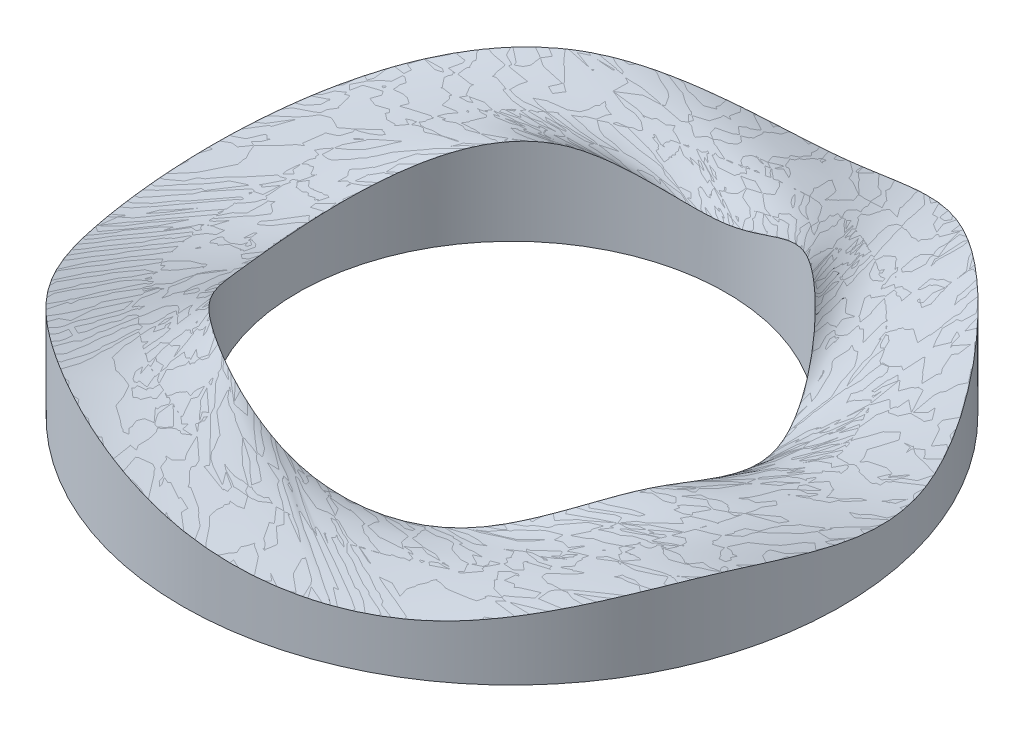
SolidWorks part; units mm, degrees
ref_plane "Ebene vorne" through (0, 0, 0) normal (0, 0, 1) x (1, 0, 0)
ref_plane "Ebene oben" through (0, 0, 0) normal (0, 1, 0) x (1, 0, 0)
ref_plane "Ebene rechts" through (0, 0, 0) normal (1, 0, 0) x (0, 0, -1)
sketch "Skizze1" plane through (0, 0, 0) normal (0, 1, 0) x (1, 0, 0)
  circle A0 centre (0, 0) radius 50
  circle A1 centre (0, 0) radius 32.5
  dimension "D1" = 100
  dimension "D2" = 65
extrude "Linear austragen1" add sketch "Skizze1" along normal blind 20
sketch "Skizze2" plane through (0, 20, 0) normal (0, 1, 0) x (1, 0, 0)
  line L0 (0, 0) -> (0, -50) construction
  line L1 (0, 0) -> (-29.3893, -40.4508) construction
  line L2 (0, 0) -> (-47.5528, -15.4508) construction
  line L3 (0, 0) -> (-47.5528, 15.4508) construction
  line L4 (0, 0) -> (-29.3893, 40.4508) construction
  line L5 (0, 0) -> (0, 50) construction
  line L6 (0, 0) -> (29.3893, 40.4508) construction
  line L7 (0, 0) -> (47.5528, 15.4508) construction
  line L8 (0, 0) -> (47.5528, -15.4508) construction
  line L9 (0, 0) -> (29.3893, -40.4508) construction
  circle A0 centre (0, 0) radius 50 construction
sketch3d "3D-Skizze1"
  spline S0 degree 3 poles (-31.4452, 18.6778, 43.0757) (-0.2043, 8.8385, 53.4326) (31.4376, 6.1421, 43.1658) (50.853, 14.6306, 16.5023) (50.5619, 1.1765, -17.1112) (31.5931, 22.8305, -42.9231) (0.2976, 3.7946, -53.4524) (-31.3557, 16.1997, -43.2221) (-50.7913, 9.3238, -16.6139) (-50.6782, 6.5436, 16.8503) (-31.4452, 18.6778, 43.0757) (-0.2043, 8.8385, 53.4326) (31.4376, 6.1421, 43.1658) knots -0.29941 -0.200615 -0.100028 0 0.09895 0.198157 0.297725 0.40057 0.501816 0.601383 0.70059 0.799385 0.899972 1 1.09895 1.198157 1.297725 only from (0, 10, 50) to (0, 10, 50)
  point P0 (0, 10, 50)
  point P1 (29.3893, 8, 40.4508)
  point P2 (47.5528, 11, 15.4508)
  point P5 (47.5528, 7, -15.4508)
  point P6 (29.3893, 16, -40.4508)
  point P7 (0, 9, -50)
  point P8 (-29.3893, 13, -40.4508)
  point P9 (-47.5528, 10, -15.4508)
  point P10 (-47.5528, 9, 15.4508)
  point P11 (-29.3893, 15, 40.4508)
  dimension "D1" = 10
  dimension "D2" = 15
  dimension "D3" = 8
  dimension "D4" = 11
  dimension "D5" = 7
  dimension "D6" = 16
  dimension "D7" = 9
  dimension "D8" = 13
  dimension "D9" = 10
  dimension "D10" = 9
sketch3d "3D-Skizze2"
  line L1 (0, 20, 0) -> (-29.3893, 20, -40.4508) construction
  line L2 (-19.103, 20, -26.2931) -> (-19.103, 0, -26.2931) construction
  line L3 (0, 20, -32.5) -> (0, 0, -32.5) construction
  line L4 (0, 20, 0) -> (0, 20, -50) construction
  line L6 (19.103, 20, -26.2931) -> (19.103, 0, -26.2931) construction
  line L7 (0, 20, 0) -> (29.3893, 20, -40.4508) construction
  line L10 (30.9093, 20, -10.0431) -> (30.9093, 0, -10.0431) construction
  line L11 (0, 20, 0) -> (47.5528, 20, -15.4508) construction
  line L12 (30.9093, 20, 10.0431) -> (30.9093, 0, 10.0431) construction
  line L13 (0, 20, 0) -> (47.5528, 20, 15.4508) construction
  line L14 (19.103, 20, 26.2931) -> (19.103, 0, 26.2931) construction
  line L15 (0, 20, 0) -> (29.3893, 20, 40.4508) construction
  line L16 (0, 20, 32.5) -> (0, 0, 32.5) construction
  line L17 (0, 20, 0) -> (0, 20, 50) construction
  line L18 (-19.103, 20, 26.2931) -> (-19.103, 0, 26.2931) construction
  line L19 (0, 20, 0) -> (-29.3893, 20, 40.4508) construction
  line L20 (-30.9093, 20, 10.0431) -> (-30.9093, 0, 10.0431) construction
  line L21 (0, 20, 0) -> (-47.5528, 20, 15.4508) construction
  line L22 (-30.9093, 20, -10.0431) -> (-30.9093, 0, -10.0431) construction
  line L23 (0, 20, 0) -> (-47.5528, 20, -15.4508) construction
  circle A0 centre (0, 20, 0) radius 32.5 construction
  circle A1 centre (0, 0, 0) radius 32.5 construction
  spline S0 degree 3 poles (-33.0182, 9.3339, -10.8954) (-20.352, 16.1576, -28.1137) (0.44, 3.8495, -34.7837) (20.6899, 22.8978, -27.6816) (32.6928, 1.2209, -11.6079) (33.1049, 14.5673, 10.7184) (20.4799, 6.1573, 28.0297) (-0.309, 8.8902, 34.7587) (-20.4853, 18.682, 27.8927) (-32.8515, 6.5963, 11.2501) (-33.0182, 9.3339, -10.8954) (-20.352, 16.1576, -28.1137) (0.44, 3.8495, -34.7837) knots -0.296796 -0.195436 -0.098197 0 0.099026 0.201875 0.308298 0.407324 0.505521 0.603121 0.703204 0.804564 0.901803 1 1.099026 1.201875 1.308298 only from (-19.103, 13, -26.2931) to (-19.103, 13, -26.2931)
  point P0 (-19.103, 15, 26.2931)
  point P1 (-30.9093, 9, 10.0431)
  point P2 (-30.9093, 10, -10.0431)
  point P3 (-19.103, 13, -26.2931)
  point P4 (0, 9, -32.5)
  point P5 (19.103, 16, -26.2931)
  point P9 (0, 10, 32.5)
  point P10 (19.103, 8, 26.2931)
  point P14 (0, 52.5, 0)
  point P17 (0, 32.5, 0)
  point P54 (30.9093, 11, 10.0431)
  point P55 (30.9093, 7, -10.0431)
  dimension "D1" = 16
  dimension "D2" = 9
  dimension "D3" = 13
  dimension "D4" = 10
  dimension "D5" = 9
  dimension "D6" = 15
  dimension "D7" = 7
  dimension "D8" = 11
  dimension "D9" = 8
  dimension "D10" = 10
sketch "Skizze3" plane through (0, 0, 0) normal (1, 0, 0) x (0, 0, -1)
  line L0 (-50, 10) -> (-32.5, 10) construction
surface "Oberfläche-Ausformung2"
sketch "Skizze5" plane through (0, 20, 0) normal (0, 1, 0) x (1, 0, 0)
  circle A0 centre (0, 0) radius 32.5 construction
  circle A1 centre (0, 0) radius 50
  circle A2 centre (0, 0) radius 50
  circle A3 centre (0, 0) radius 32.5
  dimension "D1" = 0
extrude "Schnitt-Linear austragen2" cut sketch "Skizze5" against normal up to surface (10 mm away)
